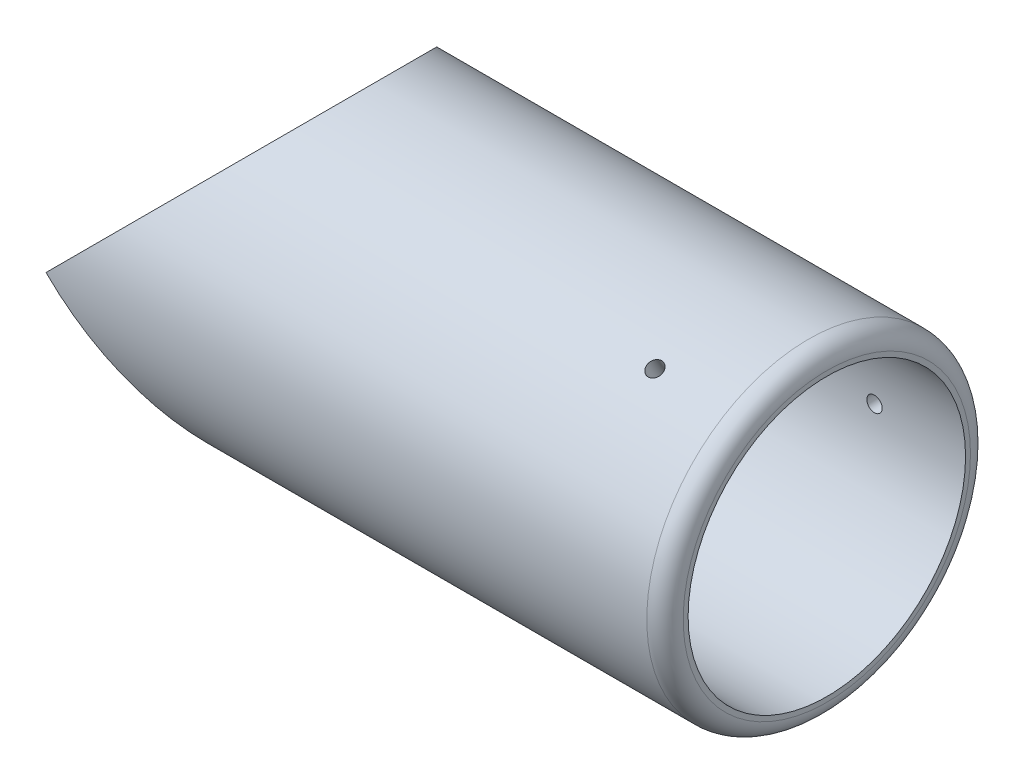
SolidWorks part; units mm, degrees
ref_plane "Front Plane" through (0, 0, 0) normal (0, 0, 1) x (1, 0, 0)
ref_plane "Top Plane" through (0, 0, 0) normal (0, 1, 0) x (1, 0, 0)
ref_plane "Right Plane" through (0, 0, 0) normal (1, 0, 0) x (0, 0, -1)
sketch "Sketch1" plane through (0, 0, 0) normal (1, 0, 0) x (0, 0, -1)
  circle A0 centre (0, 0) radius 44.45
  circle A1 centre (0, 0) radius 31.75
  dimension "D1" = 88.9
  dimension "D2" = 63.5
extrude "Boss-Extrude1" add sketch "Sketch1" along normal blind 170
sketch "Sketch2" plane through (0, 0, 0) normal (0, 1, 0) x (1, 0, 0)
  circle A0 centre (0, 0) radius 44.45
  dimension "D1" = 88.9
extrude "Cut-Extrude1" cut sketch "Sketch2" against normal up to next and the other way up to next
sketch "Sketch3" plane through (170, 0, 0) normal (1, 0, 0) x (0, 0, -1)
  circle A0 centre (0, 0) radius 38.1
  dimension "D1" = 76.2
extrude "Cut-Extrude2" cut sketch "Sketch3" against normal blind 100.1
fillet "Fillet2" radius 5 1 edges at (170, 0, -44.45)
ref_plane "Plane1" through (0, 0, -44.45) normal (0, 0, -1) x (-1, 0, 0)
hole_wizard "M5x0.8 Tapped Hole1" positions "Sketch5" profile "Sketch4" tap size "M5x0.8" standard "Ansi Metric"
sketch "Sketch5" plane through (0, 0, -44.45) normal (0, 0, -1) x (-1, 0, 0)
  line L0 (-170, 39.45) -> (-170, -39.45) construction
  point P1 (-145, 0)
  dimension "D1" = 25
sketch "Sketch4" plane through (145, 0, -44.45) normal (1, 0, 0) x (0, 1, 0)
  line L0 (0, 0) -> (0, 88.9)
  line L1 (0, 88.9) -> (2.1, 88.9)
  line L2 (2.1, 88.9) -> (2.1, 0)
  line L5 (2.1, 0) -> (0, 0)
  line L11 (0, -6.35) -> (0, 107.95) construction
  dimension "Thru Tap Drill Dia." = 4.2
  dimension "Thru Tap Drill Depth" = 88.9
pattern_circular "CirPattern1" count 3 over 360 about axis through (69.9, 0, 0) along (1, 0, 0) of "M5x0.8 Tapped Hole1"
